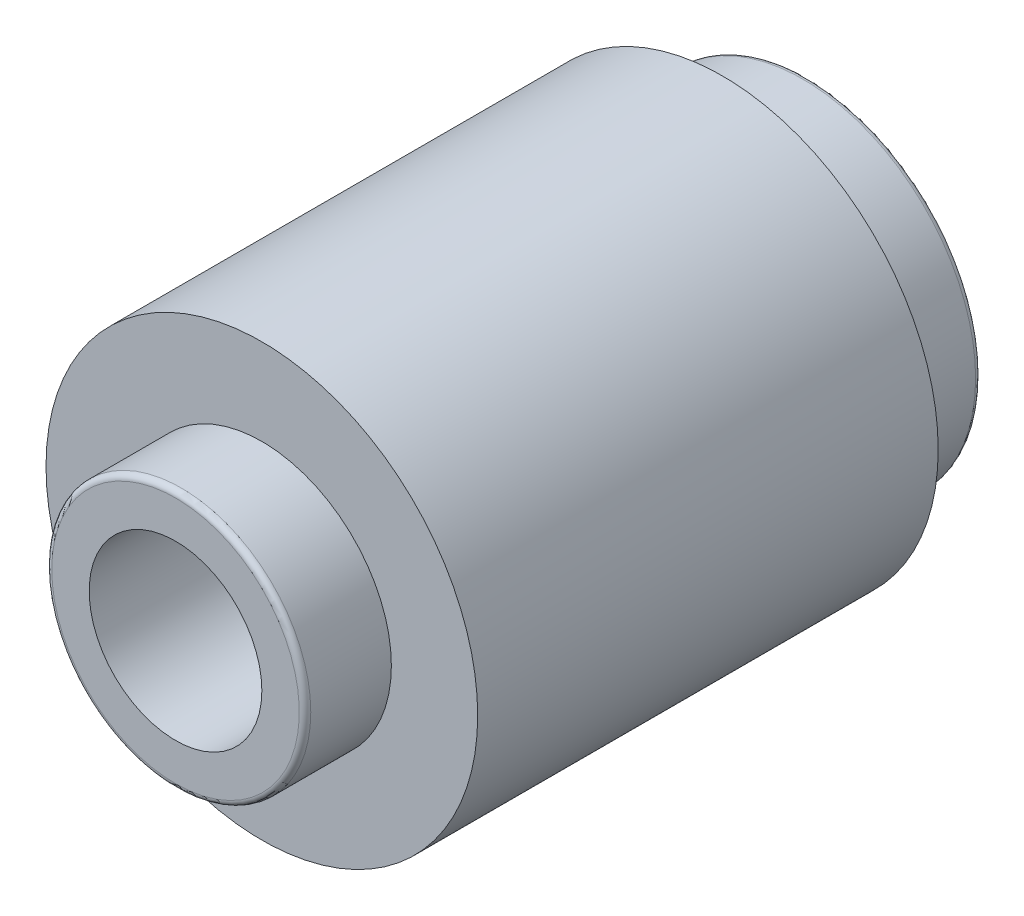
SolidWorks part; units mm, degrees
ref_plane "Face" through (0, 0, 0) normal (0, 0, 1) x (1, 0, 0)
ref_plane "Dessus" through (0, 0, 0) normal (0, 1, 0) x (1, 0, 0)
ref_plane "Droite" through (0, 0, 0) normal (1, 0, 0) x (0, 0, -1)
sketch "Esquisse2" plane through (0, 0, 0) normal (1, 0, 0) x (0, 0, -1)
  line L0 (-21.3614, 0) -> (17.5806, 0) construction
  line L1 (-3.4925, 3.75) -> (4.5075, 3.75)
  line L2 (-3.4925, 3.75) -> (-3.4925, 2.25)
  line L3 (-3.4925, 2.25) -> (-4.9925, 2.25)
  line L4 (-4.9925, 2.25) -> (-4.9925, 1.5)
  line L5 (-4.9925, 1.5) -> (-2.4925, 1.5)
  line L6 (-2.4925, 1.5) -> (-2.4925, 2.25)
  line L7 (-2.4925, 2.25) -> (6.0075, 2.25)
  line L8 (4.5075, 3.75) -> (4.5075, 3)
  line L9 (4.5075, 3) -> (6.0075, 3)
  line L10 (6.0075, 3) -> (6.0075, 2.25)
  dimension "D1" = 8
  dimension "D2" = 1.5
  dimension "D3" = 1.5
  dimension "D4" = 0.75
  dimension "D5" = 2.5
  dimension "D6" = 1.5
  dimension "D7" = 0.75
  dimension "D8" = 1.5
  dimension "D9" = 0.75
revolve "Base-Révolution" add sketch "Esquisse2" angle 360 about L0
fillet "Congé1" radius 0.1 2 edges at (3, 0, -6.0075) (2.25, 0, 4.9925)
